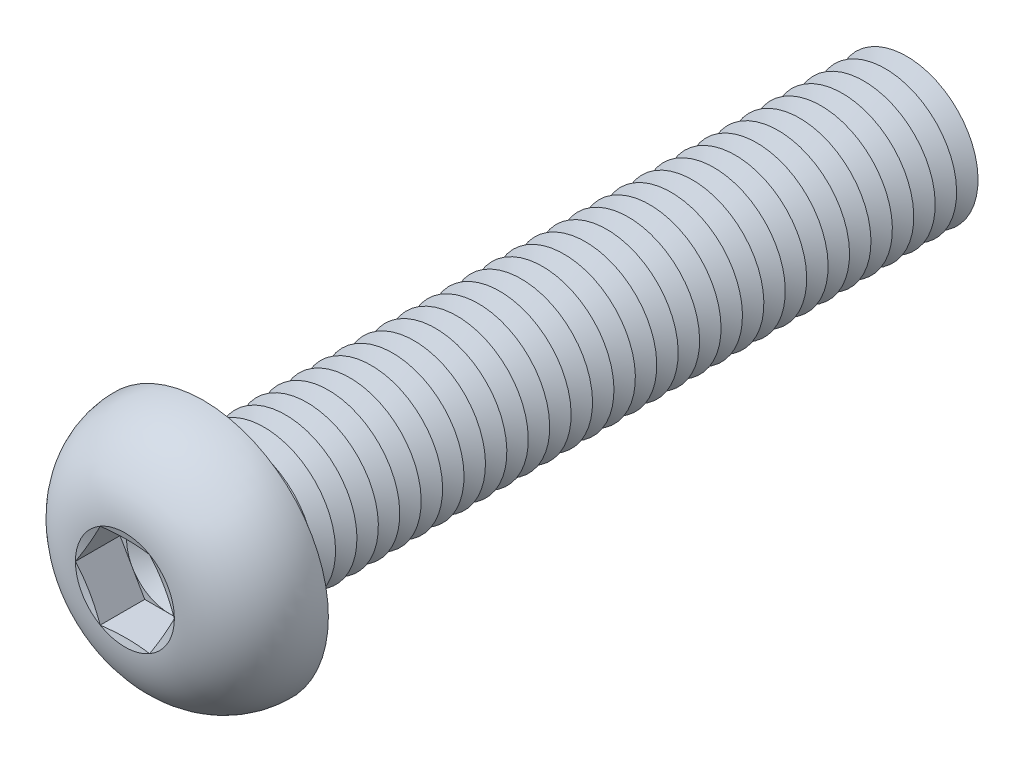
SolidWorks part; units mm, degrees
ref_plane "Front Plane" through (0, 0, 0) normal (0, 0, 1) x (1, 0, 0)
ref_plane "Top Plane" through (0, 0, 0) normal (0, 1, 0) x (1, 0, 0)
ref_plane "Right Plane" through (0, 0, 0) normal (1, 0, 0) x (0, 0, -1)
sketch "Sketch1" plane through (0, 0, 0) normal (1, 0, 0) x (0, 0, -1)
  line L0 (0, 5) -> (0, 8.75)
  line L3 (0, 5) -> (50, 5)
  line L4 (50, 5) -> (50, 0)
  line L5 (50, 0) -> (-5.5, 0) construction
  line L6 (-5.5, 0) -> (50, 0)
  line L7 (-5.5, 3.4641) -> (-5.5, 1.732) construction
  line L8 (-5.5, 1.732) -> (-5.5, 0)
  line L9 (-5.5, 3.4641) -> (-5.0359, 1.732)
  line L10 (-5.0359, 1.732) -> (-5.5, 1.732)
  line L11 (50, 0) -> (22.7481, 0) construction
  line L12 (0, 8.75) -> (-5.5, 8.75) construction
  arc A1 (0, 8.75) -> (-5.5, 3.4641) centre (0, 3.2457) ccw
  point P8 (50, 2.5)
  dimension "D1" = 17.5
  dimension "D2" = 10
  dimension "D3" = 5.5
  dimension "D4" = 6.9282
  dimension "D5" = 50
  dimension "D6" = 15
revolve "Revolve1" add sketch "Sketch1" angle 360 about L5
fillet "Fillet1" radius 0.75 1 edges at (0, 5, 0)
sketch "Sketch2" plane through (0, 0, 0) normal (1, 0, 0) x (0, 0, -1)
  line L0 (49.25, 5) -> (50.75, 5)
  line L1 (50, 5) -> (0.75, 5) construction
  line L2 (50.75, 5) -> (50, 3.701)
  line L3 (50, -5) -> (50, 5) construction
  line L4 (50, 3.701) -> (49.25, 5)
  dimension "D1" = 1.5
revolve "Cut-Revolve1" cut sketch "Sketch2" angle 360 about axis through (0, 0, -50) along (0, 0, -1)
pattern_linear "LPattern1" count 33 spacing 1.5 along (0, 0, 1) of "Cut-Revolve1"
sketch "Sketch3" plane through (0, 0, 5.5) normal (0, 0, 1) x (1, 0, 0)
  line L7 (1.732, 3) -> (-1.7321, 3)
  line L8 (-1.7321, 3) -> (-3.4641, 0)
  line L9 (-3.4641, 0) -> (-1.732, -3)
  line L10 (-1.732, -3) -> (1.732, -3)
  line L11 (1.732, -3) -> (3.4641, 0)
  line L12 (3.4641, 0) -> (1.732, 3)
  circle A0 centre (0, 0) radius 3 construction
  circle A3 centre (0, 0) radius 3.4641 construction
extrude "Cut-Extrude1" cut sketch "Sketch3" against normal blind 3.12
sketch "Sketch4" plane through (0, 0, 2.38) normal (0, 0, 1) x (1, 0, 0)
  line L1 (1.732, 3) -> (-1.7321, 3) construction
  circle A0 centre (0, 0) radius 3
extrude "Cut-Extrude2" cut sketch "Sketch4" against normal through all draft 60
